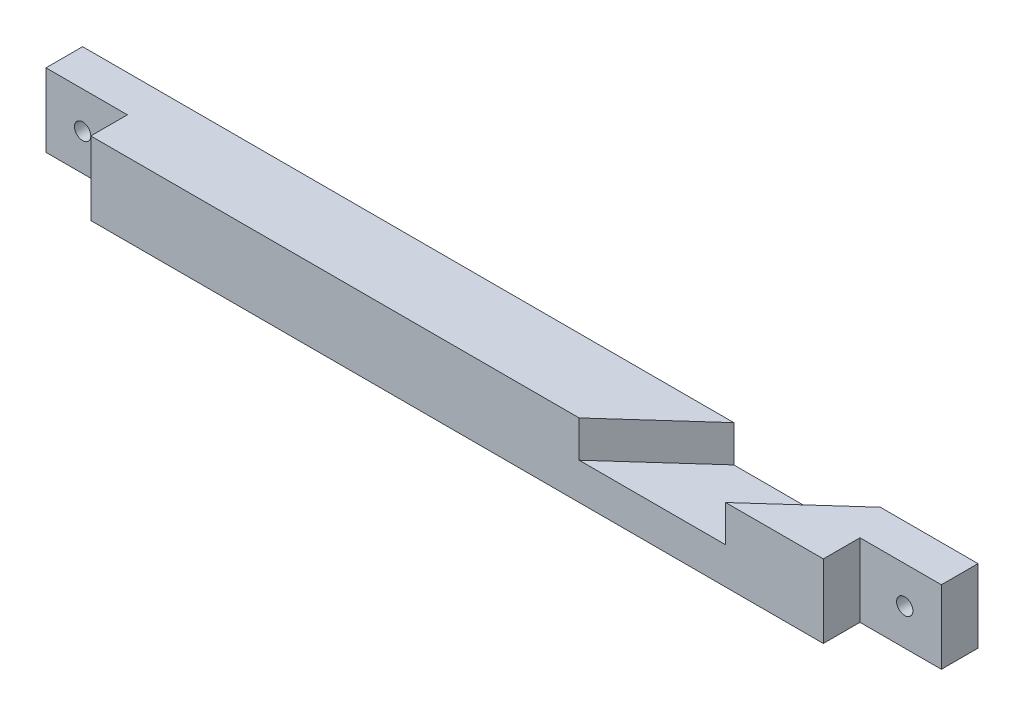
SolidWorks part; units mm, degrees
ref_plane "Face" through (0, 0, 0) normal (0, 0, 1) x (1, 0, 0)
ref_plane "Dessus" through (0, 0, 0) normal (0, 1, 0) x (1, 0, 0)
ref_plane "Droite" through (0, 0, 0) normal (1, 0, 0) x (0, 0, -1)
sketch "Esquisse1" plane through (0, 0, 0) normal (0, 0, 1) x (1, 0, 0)
  line L1 (-67.2717, -109.6176) -> (42.7283, -109.6176)
  line L2 (-67.2717, -109.6176) -> (-67.2717, -100.6176)
  line L3 (-67.2717, -100.6176) -> (42.7283, -100.6176)
  line L4 (42.7283, -109.6176) -> (42.7283, -100.6176)
  dimension "D1" = 110
  dimension "D2" = 9
extrude "Extrusion1" add sketch "Esquisse1" along normal blind 9
sketch "Esquisse2" plane through (0, 0, 9) normal (0, 0, 1) x (1, 0, 0)
  line L0 (42.7283, -100.6176) -> (-67.2717, -100.6176) construction
  line L1 (-67.2717, -109.6176) -> (-57.2717, -109.6176)
  line L2 (-67.2717, -109.6176) -> (-67.2717, -100.6176)
  line L3 (-67.2717, -100.6176) -> (-57.2717, -100.6176)
  line L4 (-57.2717, -109.6176) -> (-57.2717, -100.6176)
  line L6 (42.7283, -109.6176) -> (32.7283, -109.6176)
  line L7 (42.7283, -109.6176) -> (42.7283, -100.6176)
  line L8 (42.7283, -100.6176) -> (32.7283, -100.6176)
  line L9 (32.7283, -109.6176) -> (32.7283, -100.6176)
  dimension "D1" = 10
  dimension "D2" = 10
extrude "Enlèv. mat.-Extru.1" cut sketch "Esquisse2" against normal blind 4.5
sketch "Esquisse4" plane through (0, 0, 4.5) normal (0, 0, 1) x (1, 0, 0)
  line L0 (42.7283, -109.6176) -> (42.7283, -100.6176) construction
  line L1 (32.7283, -109.6176) -> (42.7283, -109.6176) construction
  circle A0 centre (38.2284, -105.1454) radius 1
  point P2 (42.7283, -105.1176)
  point P5 (37.7283, -109.6176)
  dimension "D3" = 2
  dimension "D1" = 4.5
  dimension "D2" = 4.5
extrude "Enlèv. mat.-Extru.2" cut sketch "Esquisse4" against normal blind 4.5
sketch "Esquisse5" plane through (0, 0, 4.5) normal (0, 0, 1) x (1, 0, 0)
  line L0 (-67.2717, -109.6176) -> (-57.2717, -109.6176) construction
  line L1 (-67.2717, -100.6176) -> (-67.2717, -109.6176) construction
  circle A0 centre (-62.7717, -105.1176) radius 1
  dimension "D1" = 2
  dimension "D2" = 4.5
  dimension "D3" = 4.5
extrude "Enlèv. mat.-Extru.3" cut sketch "Esquisse5" against normal blind 4.5
sketch "Esquisse8" plane through (0, -100.6176, 0) normal (0, 1, 0) x (1, 0, 0)
  line L0 (30.7283, 0) -> (20.7283, -9)
  line L1 (42.7283, 0) -> (-67.2717, 0) construction
  line L2 (32.7283, -9) -> (-57.2717, -9) construction
  line L3 (20.7283, -9) -> (2.7283, -9)
  line L4 (2.7283, -9) -> (12.7283, 0)
  line L5 (12.7283, 0) -> (30.7283, 0)
  dimension "D1" = 12
  dimension "D2" = 18
  dimension "D3" = 12
  dimension "D4" = 18
extrude "Enlèv. mat.-Extru.4" cut sketch "Esquisse8" against normal blind 4.5
sketch "Esquisse9" plane through (0, -105.1176, 0) normal (0, 1, 0) x (1, 0, 0)
  line L0 (2.7283, -9) -> (20.7283, -9) construction
  circle A0 centre (17.7283, -4.5) radius 1
  dimension "D3" = 2
  dimension "D1" = 25
  dimension "D2" = 4.5
extrude "Enlèv. mat.-Extru.5" cut sketch "Esquisse9" against normal blind 4.5
